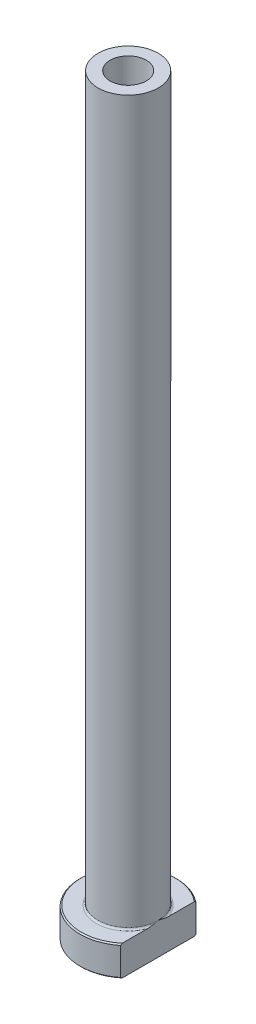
SolidWorks part; units mm, degrees
ref_plane "Front Plane" through (0, 0, 0) normal (0, 0, 1) x (1, 0, 0)
ref_plane "Top Plane" through (0, 0, 0) normal (0, 1, 0) x (1, 0, 0)
ref_plane "Right Plane" through (0, 0, 0) normal (1, 0, 0) x (0, 0, -1)
sketch "Sketch1" plane through (0, 0, 0) normal (0, 0, 1) x (1, 0, 0)
  line L0 (-3, 125) -> (-5, 125)
  line L1 (-5, 125) -> (-5, 5)
  line L2 (-5, 5) -> (-8, 5)
  line L3 (-8, 5) -> (-8, 0)
  line L4 (7.15, 0) -> (-7.15, 0) construction
  line L5 (-8, 0) -> (-3.25, 0)
  line L6 (-3, 80) -> (-3, 125)
  line L7 (0, 92.1877) -> (0, -15.5353) construction
  line L8 (0, -8.8) -> (0, 8.8) construction
  line L9 (-3, 80) -> (-3.25, 68)
  line L10 (-3.25, 68) -> (-3.25, 0)
  dimension "D1" = 0.25
  dimension "ID" = 6
  dimension "OD" = 10
  dimension "L" = 125
  dimension "H" = 16
  dimension "T" = 5
  dimension "N" = 45
  dimension "D2" = 12
  dimension "L-N" = 80
revolve "Revolve1" add sketch "Sketch1" angle 360 about L7
fillet "Fillet1" radius 0.3 1 edges at (0, 5, 5)
chamfer "Chamfer1" distance 0.2 angle 45 2 edges at (0, 5, 8) (0, 0, 8)
sketch "Sketch2" plane through (0, 0, 0) normal (0, -1, 0) x (1, 0, 0)
  line L0 (5, 6.245) -> (5, -6.245)
  circle A0 centre (0, 0) radius 8 construction
  arc A1 (5, 6.245) -> (5, -6.245) centre (0, 0) cw
  circle A2 centre (0, 0) radius 5 construction
extrude "Cut-Extrude1" cut sketch "Sketch2" against normal through all
chamfer "Chamfer2" distance 0.5 angle 45 1 edges at (0, 0, 3.25)
